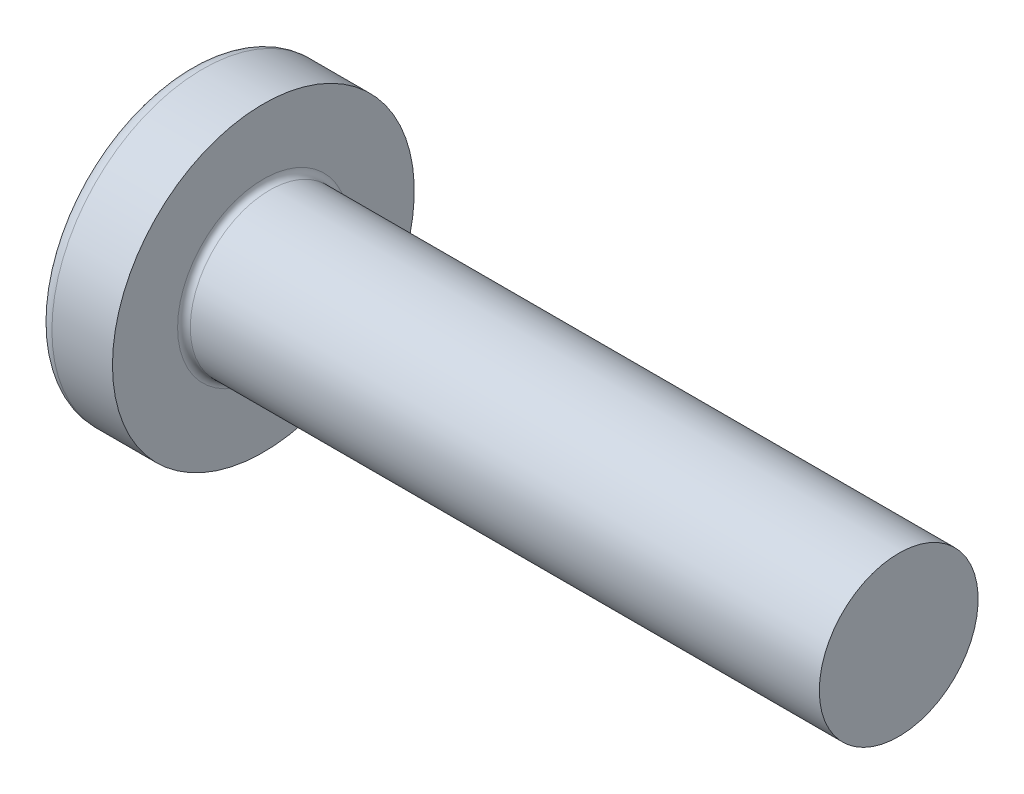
SolidWorks part; units mm, degrees
ref_plane "Plane1" through (0, 0, 0) normal (0, 0, 1) x (1, 0, 0)
ref_plane "Plane2" through (0, 0, 0) normal (0, 1, 0) x (1, 0, 0)
ref_plane "Plane3" through (0, 0, 0) normal (1, 0, 0) x (0, 0, -1)
sketch "BodySke" plane through (0, 0, 0) normal (0, 0, 1) x (1, 0, 0)
  line L0 (3.7, 2.5) -> (3.7, 4.75)
  line L1 (4.1, 6.35) -> (4.1, -3.175) construction
  line L2 (-25.4, 0) -> (127, 0) construction
  line L3 (23.7, 0) -> (0, 0)
  line L4 (3.7, 2.5) -> (23.7, 2.5)
  line L5 (23.7, 2.5) -> (23.7, 0)
  line L6 (1.7942, 4.75) -> (3.7, 4.75)
  line L8 (3.7, 6.35) -> (3.7, -3.175) construction
  arc A0 (1.4243, 4.5563) -> (0, 0) centre (8, 0) ccw
  arc A2 (1.4243, 4.5563) -> (1.7942, 4.75) centre (1.7942, 4.3) cw
revolve "Base-Revolve" add sketch "BodySke"
fillet "Fillet1" radius 0.2 1 edges at (3.7, 0, 2.5)
sketch "Sketch3" plane through (0, 0, 0) normal (1, 0, 0) x (0, 0, -1)
  line L0 (0.515, -2.35) -> (-0.515, -2.35)
  line L1 (0.515, -2.35) -> (0.515, 2.35)
  line L2 (-0.515, 2.35) -> (0.515, 2.35)
  line L3 (-0.515, 2.35) -> (-0.515, -2.35)
ref_plane "Plane4" through (2.74, 0, 0) normal (1, 0, 0) x (0, 0, -1)
sketch "Sketch4" plane through (2.74, 0, 0) normal (1, 0, 0) x (0, 0, -1)
  line L0 (0.515, -0.9839) -> (-0.515, -0.9839)
  line L1 (0.515, -0.9839) -> (0.515, 0.9839)
  line L2 (-0.515, 0.9839) -> (0.515, 0.9839)
  line L3 (-0.515, 0.9839) -> (-0.515, -0.9839)
loft "Recess" cut profiles "Sketch3", "Sketch4"
pattern_circular "RecPat" count 2 every 90 about axis through (0, 0, 0) along (1, 0, 0) of "Recess"
sketch "RecCorSke" plane through (0, 0, 0) normal (0, 0, 1) x (1, 0, 0)
  line L0 (-3.175, 0) -> (15.875, 0) construction
  line L1 (-25.4, 0) -> (127, 0) construction
  line L2 (0, 0) -> (0, 1.0426)
  line L3 (0, 1.0426) -> (2.74, 0.851)
  line L4 (2.74, 0.851) -> (3.0165, 0)
  line L5 (3.0165, 0) -> (0, 0)
revolve "RecessCore" cut sketch "RecCorSke" angle 360 about L0
sketch "ThdSchSke" plane through (0, 0, 0) normal (0, 0, 1) x (1, 0, 0)
  line L0 (5.3, -2.055) -> (4.9884, -2.5)
  line L1 (5.3, -2.055) -> (5.6116, -2.5)
  line L2 (5.6116, -2.5) -> (5.6116, -3.125)
  line L3 (-3.175, 0) -> (5.1513, 0) construction
  line L5 (5.6116, -3.125) -> (4.9884, -3.125)
  line L6 (4.9884, -3.125) -> (4.9884, -2.5)
revolve "ThreadSchematic" [suppressed] cut sketch "ThdSchSke" angle 360 about L3
pattern_linear "ThdSchPat" [suppressed]
equation "\"D1@Sketch3\" = \"Cross_dia@Sketch3\" / 2"
equation "\"D2@Sketch3\" = \"Cross_width@Sketch3\" / 2"
equation "\"Depth@RecCorSke\" = \"Cross_depth@Plane4\""
equation "\"D1@Sketch4\" = \"Cross_width@Sketch3\""
equation "\"D2@Sketch4\" = \"Cross_dia@Sketch3\" - 2.0 * \"Cross_depth@Plane4\" * tan(26.5  * 0.017453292)"
equation "\"D3@Sketch4\" = \"D1@Sketch4\" / 2"
equation "\"D4@Sketch4\" = \"D2@Sketch4\" / 2"
equation "\"Thread_length@ThreadCosmetic\" = ((sgn( (\"Length@BodySke\" - \"Advance@BodySke\" * 2.0 ) - \"Thread_nom@BodySke\" )-1)*( (\"Length@BodySke\" - \"Advance@BodySke\" * 2.0 ) - \"Thread_nom@BodySke\" ))/-2+ \"Thread_"
equation "\"Thread_minor@ThdSchSke\" = \"Thread_minor@ThreadCosmetic\""
equation "\"Diameter@ThdSchSke\" = \"Diameter@BodySke\""
equation "\"Overcut@ThdSchSke\" = \"Diameter@BodySke\" * 1.25"
equation "\"Start@ThdSchSke\" = \"Head_ht@BodySke\" + \"Length@BodySke\" - \"Thread_length@ThreadCosmetic\"  '---Non-countersunk---"
equation "\"Num_threads@ThdSchPat\" = int( \"Thread_length@ThreadCosmetic\" / \"Advance@BodySke\" + 0.999 )  + 1"
equation "\"Advance@ThdSchPat\" = \"Thread_length@ThreadCosmetic\" /  (\"Num_threads@ThdSchPat\" - 1) 'relax it"
